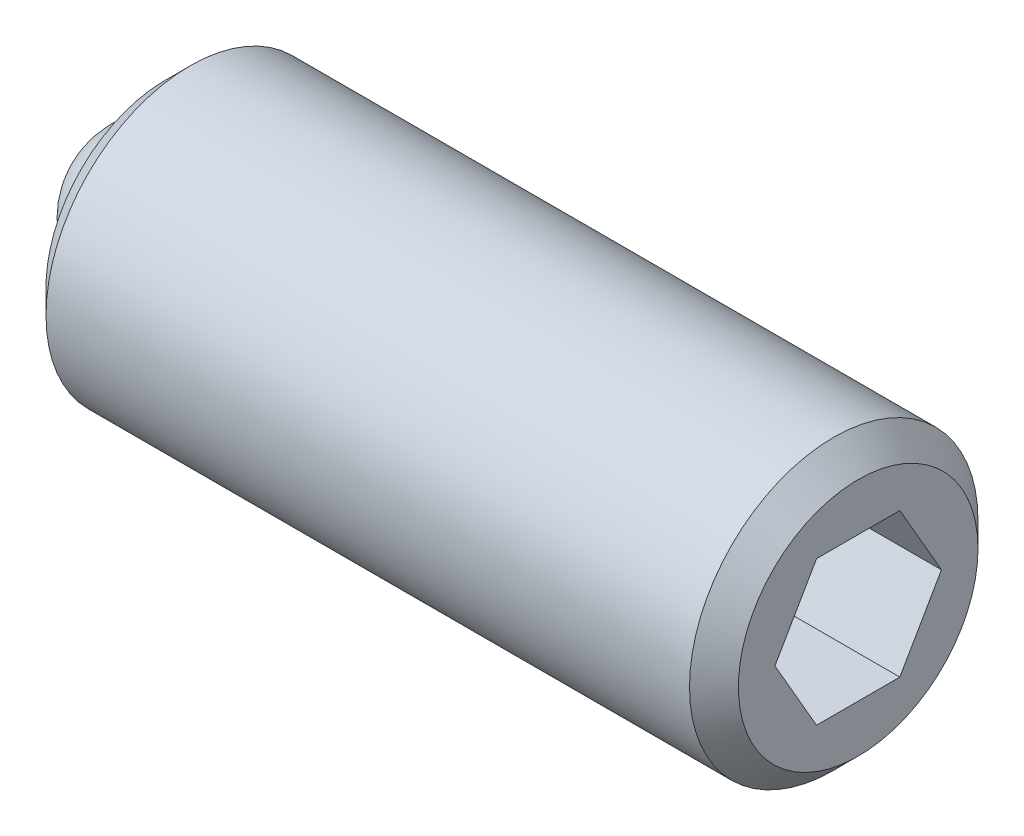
SolidWorks part; units mm, degrees
ref_plane "Front Plane" through (0, 0, 0) normal (0, 0, 1) x (1, 0, 0)
ref_plane "Top Plane" through (0, 0, 0) normal (0, 1, 0) x (1, 0, 0)
ref_plane "Right Plane" through (0, 0, 0) normal (1, 0, 0) x (0, 0, -1)
sketch "Sketch2" plane through (0, 0, 0) normal (1, 0, 0) x (0, 0, -1)
  circle A0 centre (0, 0) radius 1.5
  dimension "D1" = 3
extrude "Boss-Extrude1" add sketch "Sketch2" along normal blind 7.2
sketch "Sketch3" plane through (0, 0, 0) normal (-1, 0, 0) x (0, 0, 1)
  circle A0 centre (0, 0) radius 0.8
  dimension "D1" = 1.6
chamfer "Chamfer1" distance 0.254 angle 45 1 edges at (0, 0, -1.5)
chamfer "Chamfer2" distance 0.254 angle 45 1 edges at (7.2, 0, -1.5)
sketch "Sketch4" plane through (7.2, 0, 0) normal (1, 0, 0) x (0, 0, -1)
  line L1 (0.866, 0) -> (0.433, 0.75)
  line L2 (0.433, 0.75) -> (-0.433, 0.75)
  line L3 (-0.433, 0.75) -> (-0.866, 0)
  line L4 (-0.866, 0) -> (-0.433, -0.75)
  line L5 (-0.433, -0.75) -> (0.433, -0.75)
  line L6 (0.433, -0.75) -> (0.866, 0)
  circle A0 centre (0, 0) radius 0.75 construction
  dimension "D1" = 1.5
extrude "Cut-Extrude2" cut sketch "Sketch4" against normal blind 2
extrude "Cut-Extrude3" cut sketch "Sketch3" against normal blind 0.8
sketch "Sketch5" plane through (0, 0, 0) normal (-1, 0, 0) x (0, 0, 1)
  line L0 (0, 0) -> (0, -0.8)
  line L1 (0, 0) -> (0, 0.8)
  arc A0 (0, 0.8) -> (0, -0.8) centre (0, 0) ccw
  dimension "D1" = 0.8
revolve "Revolve1" add sketch "Sketch5" angle 360 about L1
sketch "Sketch7" plane through (0, 0, 0) normal (-1, 0, 0) x (0, 0, 1)
  line L0 (0, 0) -> (0, 0.8) construction
  arc A0 (0.0634, 0.7975) -> (-0.0634, 0.7975) centre (0, 0) ccw
  arc A1 (0.0634, 0.7975) -> (-0.0634, 0.7975) centre (0, 0.8) ccw
  dimension "D1" = 1.6
  dimension "D2" = 0.127
extrude "Cut-Extrude4" cut sketch "Sketch7" against normal up to surface (0.8 mm away) contours A1 A0
